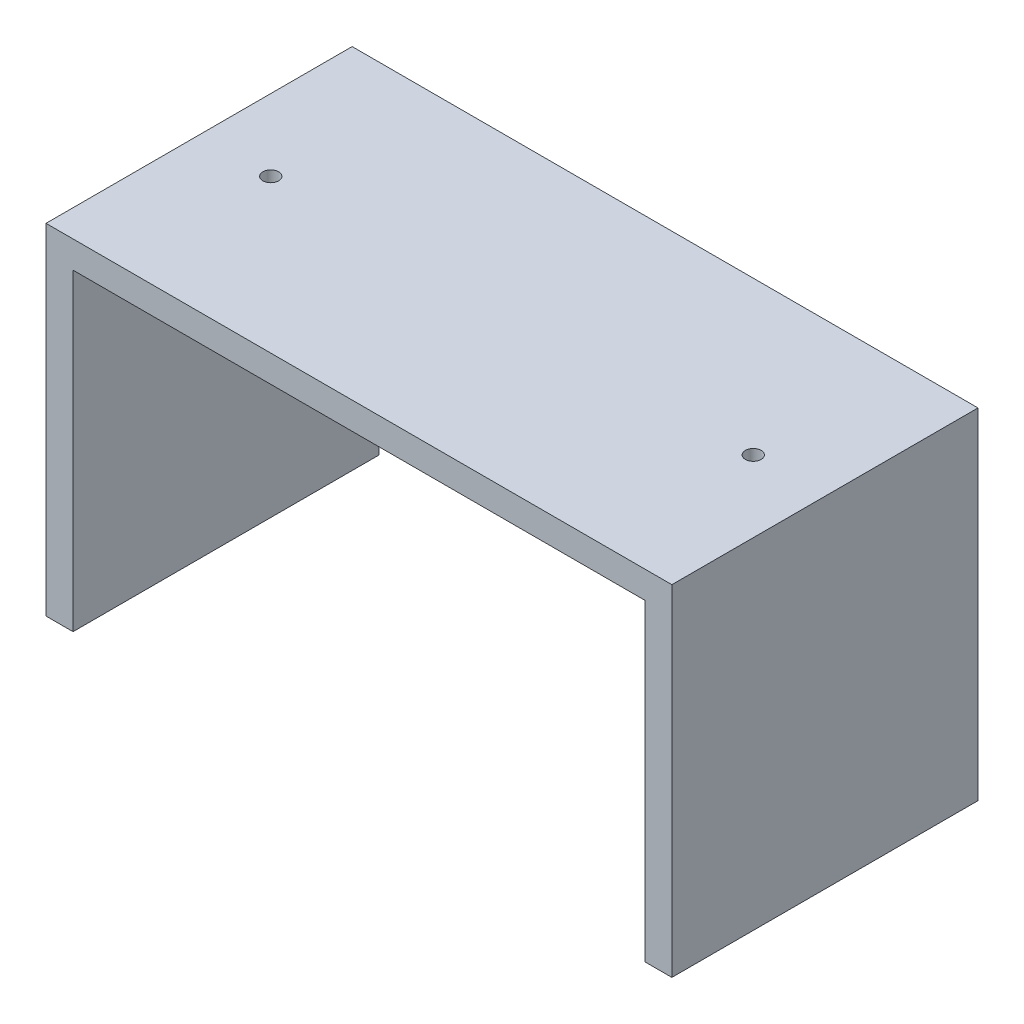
SolidWorks part; units mm, degrees
ref_plane "Front Plane" through (0, 0, 0) normal (0, 0, 1) x (1, 0, 0)
ref_plane "Top Plane" through (0, 0, 0) normal (0, 1, 0) x (1, 0, 0)
ref_plane "Right Plane" through (0, 0, 0) normal (1, 0, 0) x (0, 0, -1)
sketch "Sketch1" plane through (0, 0, 0) normal (0, 0, 1) x (1, 0, 0)
  line L0 (1.59, -20) -> (1.59, -1.59)
  line L1 (0, -20) -> (0, 0)
  line L2 (0, 0) -> (36.8, 0)
  line L3 (36.8, 0) -> (36.8, -20)
  line L4 (1.59, -1.59) -> (35.21, -1.59)
  line L5 (35.21, -1.59) -> (35.21, -20)
  line L6 (0, -20) -> (1.59, -20)
  line L7 (35.21, -20) -> (36.8, -20)
  dimension "D1" = 36.8
  dimension "D2" = 1.59
  dimension "D3" = 20
extrude "Boss-Extrude1" add sketch "Sketch1" along normal blind 18
sketch "Sketch2" plane through (0, 0, 0) normal (0, 1, 0) x (1, 0, 0)
  line L0 (0, -9) -> (36.8, -9) construction
  line L1 (0, -18) -> (0, 0) construction
  line L2 (36.8, -18) -> (36.8, 0) construction
  line L3 (4.2141, -9) -> (18.4, -9) construction
  line L4 (18.4, -9) -> (32.5859, -9) construction
  circle A0 centre (4.2141, -9) radius 0.4636
  circle A1 centre (32.5859, -9) radius 0.4635
  dimension "D1" = 0.9271
  dimension "D2" = 28.3718
extrude "Cut-Extrude1" cut sketch "Sketch2" against normal blind 10
